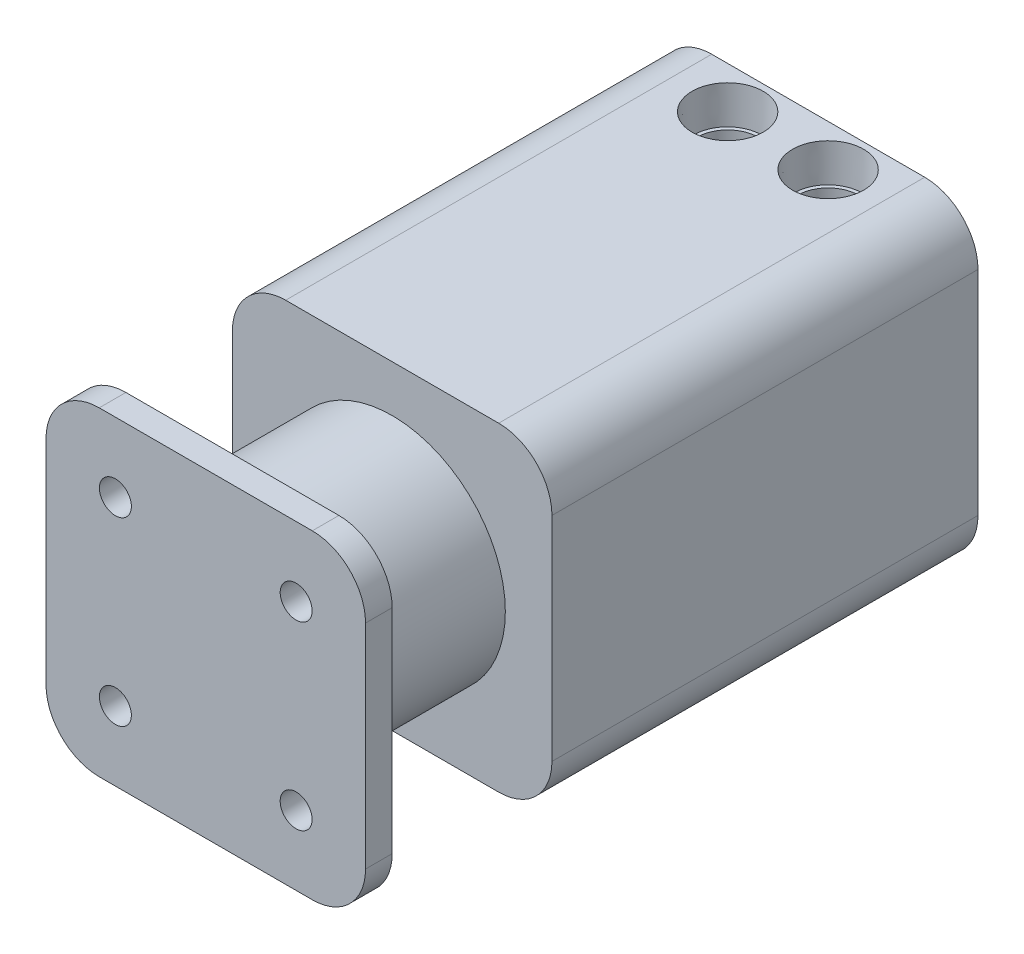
SolidWorks part; units mm, degrees
ref_plane "前视基准面" through (0, 0, 0) normal (0, 0, 1) x (1, 0, 0)
ref_plane "上视基准面" through (0, 0, 0) normal (0, 1, 0) x (1, 0, 0)
ref_plane "右视基准面" through (0, 0, 0) normal (1, 0, 0) x (0, 0, -1)
sketch "草图1" plane through (0, 0, 0) normal (0, 0, 1) x (1, 0, 0)
  line L1 (-60, 60) -> (60, 60)
  line L2 (-60, 60) -> (-60, -60)
  line L3 (-60, -60) -> (60, -60)
  line L4 (60, 60) -> (60, -60)
  dimension "D1" = 120
  dimension "D2" = 120
  dimension "D3" = 60
  dimension "D4" = 60
extrude "拉伸1" add sketch "草图1" along normal blind 230
ref_plane "基准面1" through (0, 0, 220) normal (0, 0, 1) x (1, 0, 0)
sketch "草图2" plane through (0, 0, 220) normal (0, 0, 1) x (1, 0, 0)
  line L4 (-60, 60) -> (-60, -60)
  line L5 (-60, -60) -> (60, -60)
  line L6 (60, -60) -> (60, 60)
  line L7 (60, 60) -> (-60, 60)
  line L8 (-60, 60) -> (-60, -60)
  line L9 (-60, -60) -> (60, -60)
  line L10 (60, -60) -> (60, 60)
  line L11 (60, 60) -> (-60, 60)
  circle A0 centre (0, 0) radius 42.5
  dimension "D2" = 85
  dimension "D1" = 0
extrude "切除-拉伸1" cut sketch "草图2" against normal blind 60 contours A0 L11 L8 | A0 L10 L11 | A0 L9 L10 | A0 L8 L9
fillet "圆角1" radius 20 8 edges at (-60, -60, 80) (60, -60, 80) (-60, 60, 80) (60, 60, 80) (-60, -60, 225) (-60, 60, 225) (60, -60, 225) (60, 60, 225)
sketch "草图3" plane through (0, 0, 230) normal (0, 0, 1) x (1, 0, 0)
  line L0 (0, 0) -> (-33.9411, 33.9411) construction
  line L1 (0, 0) -> (0, 35.6367) construction
  circle A0 centre (-33.9411, 33.9411) radius 6
  dimension "D2" = 48
  dimension "D3" = 12
  dimension "D1" = 45
extrude "切除-拉伸2" cut sketch "草图3" against normal blind 20
hole_wizard "3/4 NPT 螺纹孔1" positions "草图5" profile "草图4" size "3/4" standard "Ansi Inch"
sketch "草图5" plane through (0, 60, 0) normal (0, 1, 0) x (-1, 0, 0)
  point P1 (18.3052, 15.7079)
  point P3 (-19.4147, 15.7079)
sketch "草图4" plane through (-18.3052, 60, 15.7079) normal (1, 0, 0) x (0, 0, 1)
  line L0 (0, 0) -> (0, 30.0336)
  line L1 (11.5062, 23.12) -> (0, 30.0336)
  line L2 (-11.5062, 23.12) -> (0, 30.0336) construction
  line L3 (11.5062, 23.12) -> (11.5062, 14.05)
  line L4 (11.5062, 14.05) -> (12.9142, 14.05)
  line L5 (12.9142, 14.05) -> (13.3349, 0)
  line L6 (-12.9142, 14.05) -> (-13.3349, 0) construction
  line L7 (13.3349, 0) -> (0, 0)
  line L8 (0, -6.35) -> (0, 107.95) construction
  line L11 (-11.5062, 14.05) -> (-12.9142, 14.05) construction
  dimension "蹟恇謂郰芛眻噤" = 23.0124
  dimension "蹟恇謂郰芛旮僅" = 23.12
  dimension "蹟恇眻噤" = 26.6698
  dimension "蹟恇褒僅" = 3.43
  dimension "蹟恇旮僅" = 14.05
  dimension "絳芛褒僅" = 118
pattern_circular "阵列(圆周)1" count 4 over 360 about axis through (0, 0, 0) along (0, 0, 1) of "切除-拉伸2"
